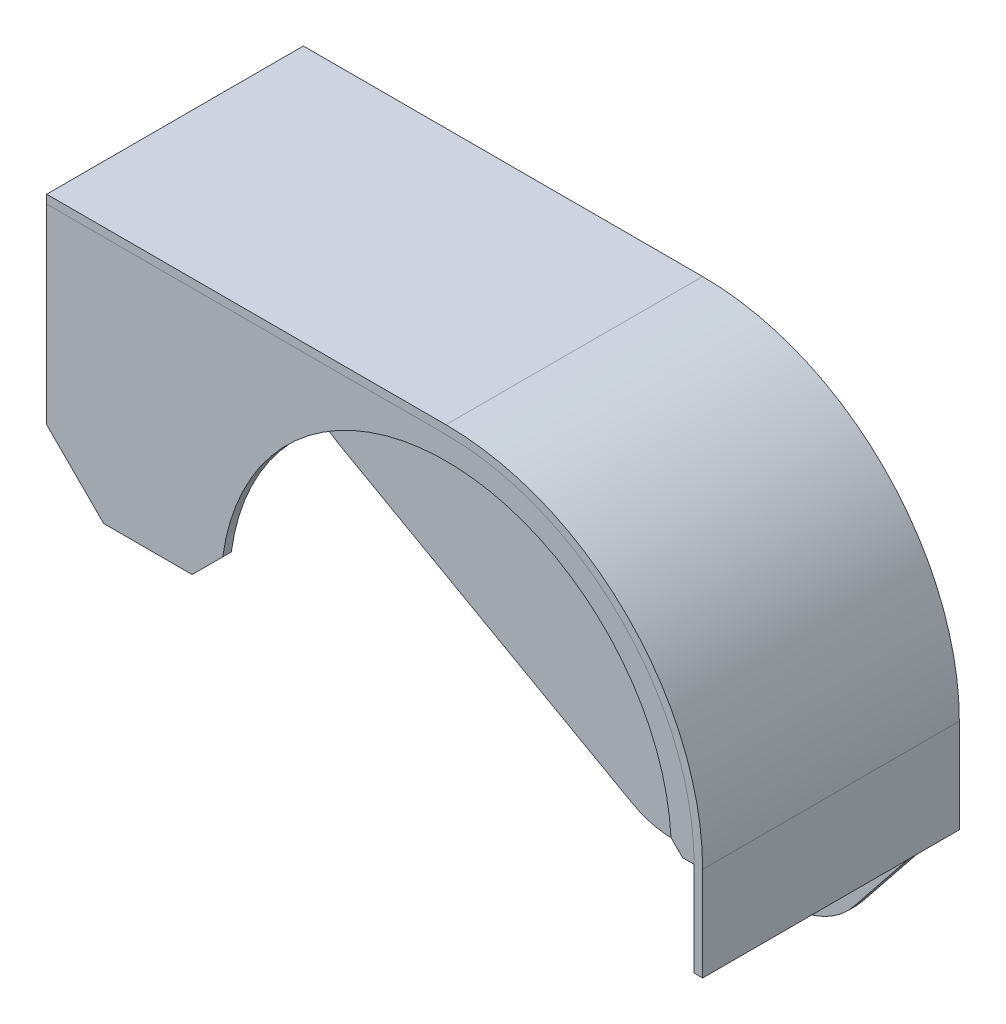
SolidWorks part; units mm, degrees
ref_plane "Face" through (0, 0, 0) normal (0, 0, 1) x (1, 0, 0)
ref_plane "Dessus" through (0, 0, 0) normal (0, 1, 0) x (1, 0, 0)
ref_plane "Droite" through (0, 0, 0) normal (1, 0, 0) x (0, 0, -1)
sketch "Esquisse10" plane through (0, 0, 0) normal (0, 0, 1) x (1, 0, 0)
  circle A0 centre (0, 0) radius 80
  dimension "D1" = 160
sketch "Esquisse1" plane through (0, 0, 0) normal (0, 0, 1) x (1, 0, 0)
  line L0 (-140, 87) -> (0, 87)
  line L1 (-140, 87) -> (-140, -13)
  line L2 (-140, 87) -> (-140, 60) construction
  line L3 (-140, 60) -> (-59.0844, 60) construction
  line L4 (-59.0844, 60) -> (-32.8892, -11.9707) construction
  line L5 (-140, -13) -> (-15, -83)
  line L6 (14.0805, -32.0428) -> (87, 0) construction
  line L7 (0, 0) -> (65.9991, -114.3138) construction
  line L8 (0, 0) -> (0, -151.6391) construction
  line L10 (87, 0) -> (87, -33)
  line L11 (87, -33) -> (47, -83)
  line L12 (47, -83) -> (-15, -83)
  arc A0 (-32.8892, -11.9707) -> (14.0805, -32.0428) centre (0, 0) ccw construction
  arc A2 (87, 0) -> (0, 87) centre (0, 0) ccw
  dimension "D1" = 70
  dimension "D2" = 140
  dimension "D7" = 87
  dimension "D3" = 100
  dimension "D4" = 110
  dimension "D5" = 87
  dimension "D6" = 30
  dimension "D9" = 125
  dimension "D10" = 70
  dimension "D11" = 50
  dimension "D12" = 40
extrude "Extrusion1" add sketch "Esquisse1" against normal blind 3
sketch "Esquisse2" plane through (0, 0, -3) normal (0, 0, -1) x (-1, 0, 0)
  line L0 (140, 87) -> (140, -13) construction
  line L1 (0, 87) -> (140, 87)
  line L2 (0, 90) -> (140, 90)
  line L3 (140, 90) -> (140, 87)
  line L6 (0, 87) -> (140, 87) construction
  line L8 (-90, 0) -> (-90, -33)
  line L10 (-90, -33) -> (-87, -33)
  line L11 (-87, -33) -> (-87, 0)
  arc A1 (0, 87) -> (-87, 0) centre (0, 0) ccw
  arc A3 (0, 90) -> (-90, 0) centre (0, 0) ccw
  arc A4 (0, 87) -> (-87, 0) centre (0, 0) ccw construction
  dimension "D1" = 3
extrude "Extrusion2" add sketch "Esquisse2" against normal blind 90 separate body
hole_wizard "Dégagement M61" positions "Esquisse4" profile "Esquisse3" hole size "M6" standard "ISO"
sketch "Esquisse4" plane through (0, 0, 0) normal (0, 0, 1) x (1, 0, 0)
  point P0 (30, 0)
  dimension "D1" = 30
sketch "Esquisse3" plane through (30, 0, 0) normal (1, 0, 0) x (0, -1, 0)
  line L0 (0, 0) -> (0, 11.9828)
  line L1 (0, 11.9828) -> (3.3, 10)
  line L2 (3.3, 10) -> (3.3, 0)
  line L5 (3.3, 0) -> (0, 0)
  line L10 (0, 11.9828) -> (-3.3, 10) construction
  line L11 (0, -6.35) -> (0, 107.95) construction
  dimension "Diamètre du perçage" = 6.6
  dimension "Profondeur du perçage" = 10
  dimension "Angle de pointe" = 118
pattern_circular "Répétition circulaire1" count 6 over 360 about axis through (0, 0, 0) along (0, 0, 1) of "Dégagement M61"
fillet "Congé1" radius 30 3 edges at (-140, -13, -1.5) (47, -83, -1.5) (-15, -83, -1.5)
chamfer "Chanfrein1" [suppressed] distance 10 angle 45
sketch "Esquisse8" plane through (0, 0, 0) normal (0, 0, 1) x (1, 0, 0)
  circle A0 centre (0, 0) radius 20
  dimension "D1" = 40
extrude "Enlèv. mat.-Extru.1" cut sketch "Esquisse8" against normal up to next
sketch "Esquisse11" plane through (0, 0, 87) normal (0, 0, 1) x (1, 0, 0)
  line L0 (-140, 87) -> (-140, 0)
  line L1 (-79, 0) -> (-140, 0)
  line L3 (-140, 87) -> (-140, 4.5837) construction
  line L4 (79, 0) -> (87, 0)
  line L5 (0, 87) -> (-140, 87)
  arc A0 (79, 0) -> (-79, 0) centre (0, 0) ccw
  arc A2 (87, 0) -> (0, 87) centre (0, 0) ccw construction
  arc A3 (87, 0) -> (0, 87) centre (0, 0) ccw
  dimension "D1" = 79
extrude "Extrusion3" add sketch "Esquisse11" against normal blind 3 separate body
chamfer "Chanfrein2" distance 20 angle 45 1 edges at (-140, 0, 85.5)
chamfer "Chanfrein3" distance 10 angle 45 1 edges at (-79, 0, 85.5)
sketch "Esquisse12" plane through (-140, 0, 0) normal (-1, 0, 0) x (0, 0, 1)
  line L1 (84, 87) -> (0, 87)
  line L2 (84, 87) -> (84, 62)
  line L3 (84, 62) -> (0, 62)
  line L4 (0, 87) -> (0, 62)
  line L5 (0, 87) -> (0, 4.5837) construction
  dimension "D1" = 25
extrude "Extrusion4" add sketch "Esquisse12" against normal blind 3 separate body
chamfer "Chanfrein4" distance 4 angle 45 1 edges at (79, 0, 85.5)
sketch "Esquisse13" plane through (0, 0, 87) normal (0, 0, 1) x (1, 0, 0)
  line L1 (-161.21, 0) -> (104.0724, 0)
  line L2 (-161.21, 0) -> (-161.21, 91.9274)
  line L3 (-161.21, 91.9274) -> (104.0724, 91.9274)
  line L4 (104.0724, 0) -> (104.0724, 91.9274)
extrude "Enlèv. mat.-Extru.2" [suppressed] cut sketch "Esquisse13" against normal through all
